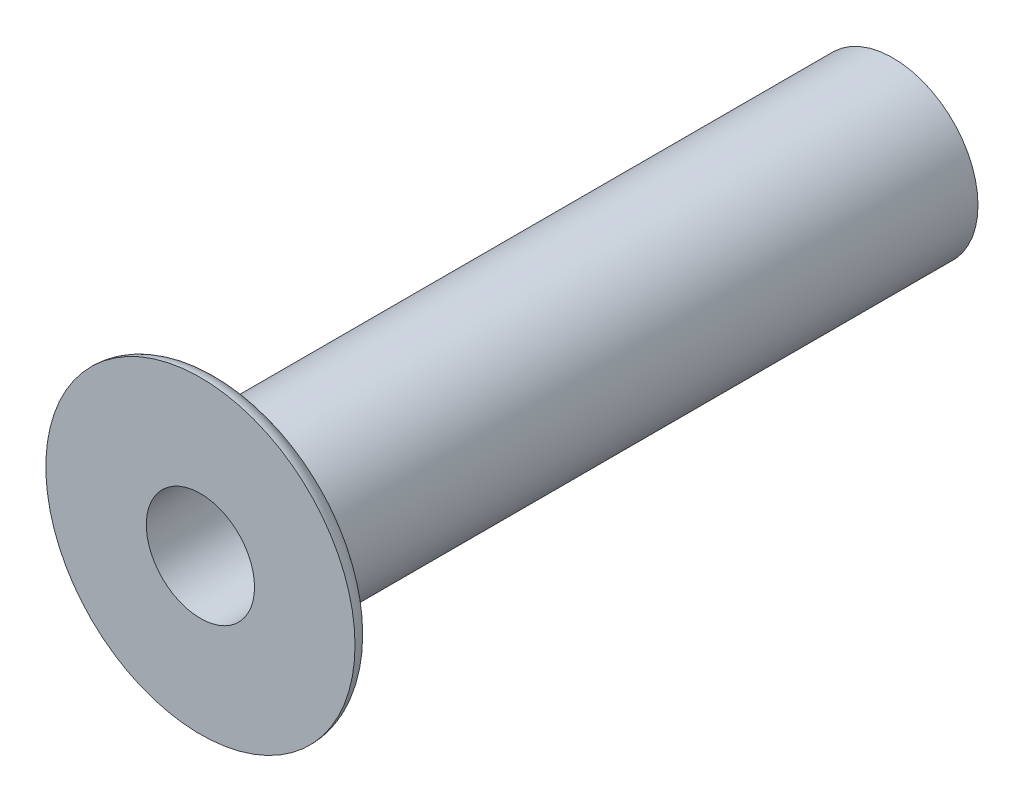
SolidWorks part; units mm, degrees
ref_plane "Front Plane" through (0, 0, 0) normal (0, 0, 1) x (1, 0, 0)
ref_plane "Top Plane" through (0, 0, 0) normal (0, 1, 0) x (1, 0, 0)
ref_plane "Right Plane" through (0, 0, 0) normal (1, 0, 0) x (0, 0, -1)
sketch "Sketch1" plane through (0, 0, 0) normal (0, 0, 1) x (1, 0, 0)
  circle A0 centre (0, 0) radius 2.2225
  circle A1 centre (0, 0) radius 3.4925
  dimension "D1" = 4.445
  dimension "D2" = 1.27
extrude "Boss-Extrude1" add sketch "Sketch1" along normal blind 28.448
sketch "Sketch2" plane through (0, 0, 28.448) normal (0, 0, 1) x (1, 0, 0)
  circle A0 centre (0, 0) radius 6.35
  circle A1 centre (0, 0) radius 2.2225
extrude "Boss-Extrude2" add sketch "Sketch2" against normal blind 0.762
fillet "Fillet1" radius 0.762 2 edges at (3.4925, 0, 27.686) (6.35, 0, 27.686)
